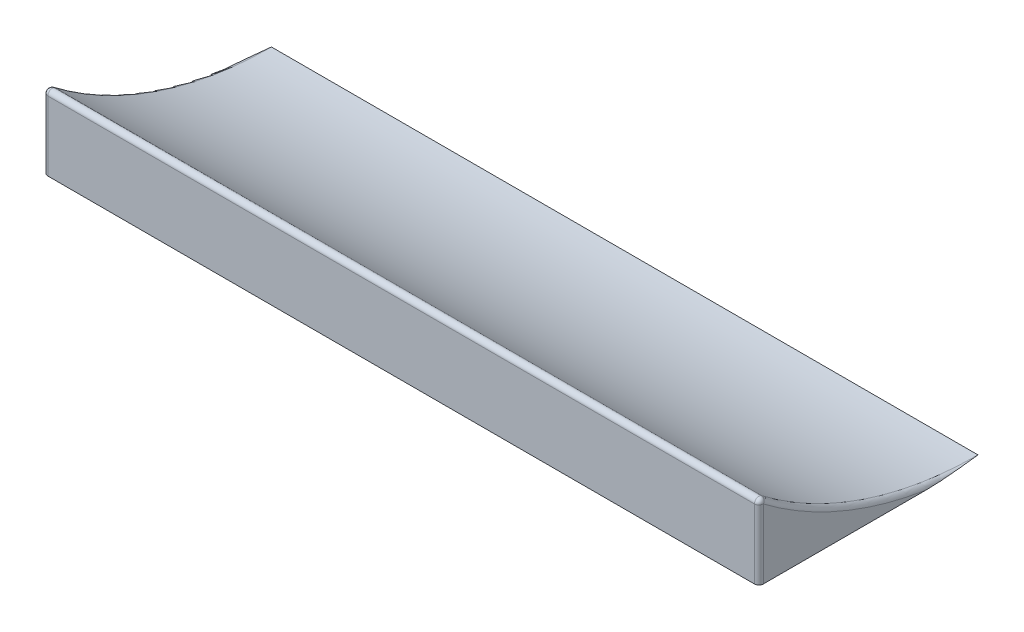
SolidWorks part; units mm, degrees
ref_plane "Plan de face" through (0, 0, 0) normal (0, 0, 1) x (1, 0, 0)
ref_plane "Plan de dessus" through (0, 0, 0) normal (0, 1, 0) x (1, 0, 0)
ref_plane "Plan de droite" through (0, 0, 0) normal (1, 0, 0) x (0, 0, -1)
sketch "Esquisse1" plane through (0, 0, 0) normal (1, 0, 0) x (0, 0, -1)
  line L0 (0, 0) -> (500, 0)
  line L1 (500, 0) -> (0, 175.5002) construction
  line L2 (0, 0) -> (0, 175.5002)
  arc A0 (500, 0) -> (0, 175.5002) centre (500, 800) cw
  dimension "D3" = 800
  dimension "D1" = 90
  dimension "D2" = 500
extrude "Boss.-Extru.1" add sketch "Esquisse1" along normal mid plane 1600
sketch "Esquisse2" plane through (0, 0, 0) normal (0, -1, 0) x (1, 0, 0)
  line L0 (0, -500) -> (0, 0) construction
  line L1 (800, -500) -> (-800, -500) construction
  line L2 (800, 0) -> (-800, 0) construction
  line L3 (0, -250) -> (258.9561, -250) construction
  circle A0 centre (-250, -250) radius 5
  circle A1 centre (250, -250) radius 5
  dimension "D1" = 250
extrude "Enlèv. mat.-Extru.1" cut sketch "Esquisse2" against normal blind 10
fillet "Congé1" radius 10 5 edges at (800, 87.7501, 0) (-800, 87.7501, 0) (0, 175.5002, 0) (800, 45.1491, -235.047) (-800, 45.1491, -235.047)
